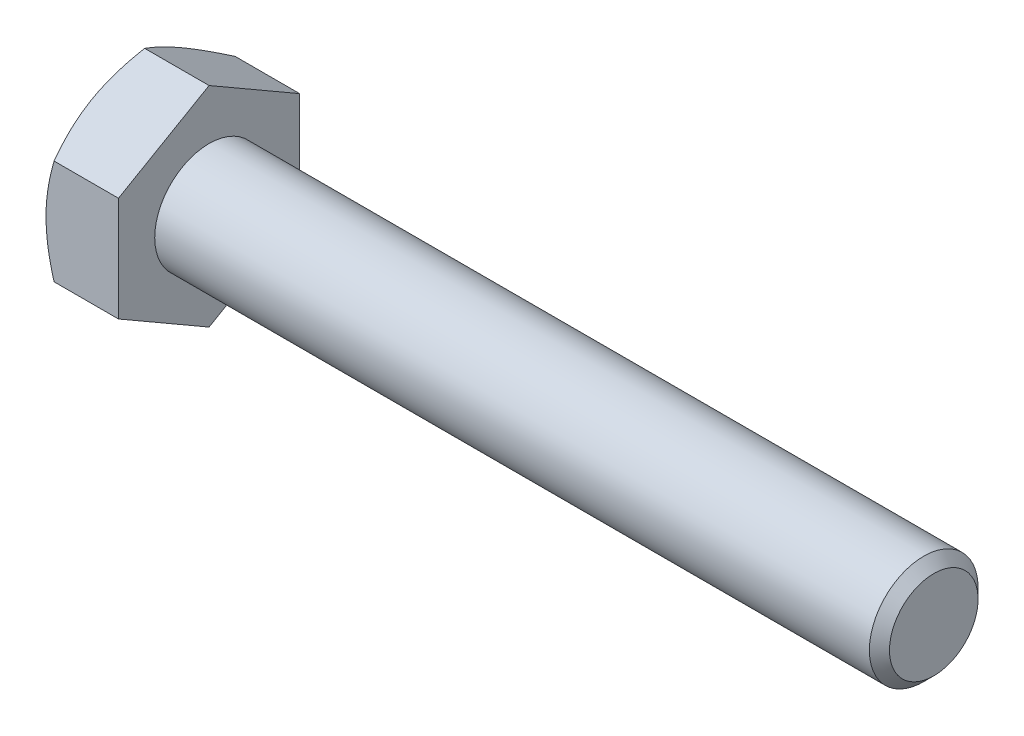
SolidWorks part; units mm, degrees
ref_plane "Plane1" through (0, 0, 0) normal (0, 0, 1) x (1, 0, 0)
ref_plane "Plane2" through (0, 0, 0) normal (0, 1, 0) x (1, 0, 0)
ref_plane "Plane3" through (0, 0, 0) normal (1, 0, 0) x (0, 0, -1)
sketch "Sketch1" plane through (0, 0, 0) normal (1, 0, 0) x (0, 0, -1)
  line L0 (5, 2.8868) -> (5, -2.8868)
  line L1 (-5, 2.8868) -> (-5, -2.8868)
  line L2 (5, -2.8868) -> (0, -5.7735)
  line L3 (0, -5.7735) -> (-5, -2.8868)
  line L4 (5, 2.8868) -> (0, 5.7735)
  line L5 (0, 5.7735) -> (-5, 2.8868)
  dimension "Width_flats" = 10
  dimension "D2" = 120
  dimension "D3" = 5
  dimension "D4" = 5
  dimension "D5" = 5
extrude "BaseHead" add sketch "Sketch1" along normal blind 4
sketch "BodySke" plane through (0, 0, 0) normal (0, 0, 1) x (1, 0, 0)
  line L1 (0, 0) -> (44, 0)
  line L2 (0, 0) -> (0, 3)
  line L4 (44, 0) -> (44, 2.4455)
  line L5 (4, 5.7735) -> (4, 2.8868) construction
  line L6 (44, 2.4455) -> (43.4455, 3)
  line L7 (0, 0) -> (110.49, 0) construction
  line L8 (44, -2.4455) -> (43.4455, -3) construction
  line L9 (0, 2.8868) -> (0, -2.8868) construction
  line L10 (5, 15.24) -> (5, -1.27) construction
  line L11 (4, 15.24) -> (4, -1.27) construction
  line L12 (4, 2.8868) -> (4, -2.8868) construction
  line L15 (0, 3) -> (43.4455, 3)
  dimension "Length" = 40
  dimension "Body_ch_ang" = 45
  dimension "Diameter" = 6
  dimension "Minor_dia" = 4.891
  dimension "Advance" = 1
  dimension "Thread_nom" = 40
revolve "BaseBody" add sketch "BodySke" angle 360 about L7
fillet "HeadFillet" [suppressed] radius 0.25
sketch "Sketch3" plane through (0, 0, 0) normal (0, 0, 1) x (1, 0, 0)
  line L0 (0, 5) -> (3.3333, 10.7735)
  line L1 (0, 5.7735) -> (0, 2.8868) construction
  line L2 (3.3333, 10.7735) -> (3.3333, 15.7735)
  line L3 (3.3333, 15.7735) -> (-10, 15.7735)
  line L4 (-10, 15.7735) -> (-10, 5)
  line L5 (-10, 5) -> (0, 5)
  line L6 (0, 0) -> (99.06, 0) construction
  line L7 (4, 5.7735) -> (0, 5.7735) construction
  dimension "D1" = 5
  dimension "D2" = 5
  dimension "D3" = 10
  dimension "D4" = 5
  dimension "Head_ch_ang" = 30
revolve "HeadChamfer" cut sketch "Sketch3" angle 360 about L6
sketch "ThdSchSke" plane through (0, 0, 0) normal (0, 0, 1) x (1, 0, 0)
  line L0 (5, -2.4455) -> (4.6117, -3)
  line L1 (5, -2.4455) -> (5.3883, -3)
  line L2 (5.3883, -3) -> (5.3883, -3.75)
  line L3 (-3.175, 0) -> (5.1513, 0) construction
  line L5 (5.3883, -3.75) -> (4.6117, -3.75)
  line L6 (4.6117, -3.75) -> (4.6117, -3)
  dimension "Thread_minor" = 4.891
  dimension "Diameter" = 6
  dimension "Start" = 5
  dimension "SideAngle" = 55
  dimension "VeeAngle" = 70
  dimension "Overcut" = 7.5
revolve "ThreadSchematic" [suppressed] cut sketch "ThdSchSke" angle 360 about L3
pattern_linear "ThdSchPat" [suppressed]
equation "\"D3@Sketch1\" = \"Width_flats@Sketch1\" / 2"
equation "\"D4@Sketch1\" = \"D3@Sketch1\""
equation "\"D5@Sketch1\" = \"D4@Sketch1\""
equation "\"Thread_minor@ThreadCosmetic\" = \"Minor_dia@BodySke\""
equation "\"D1@Sketch3\" = \"Width_flats@Sketch1\" / 2"
equation "\"Thread_length@ThreadCosmetic\" = ((sgn( (\"Length@BodySke\" - \"Advance@BodySke\" ) - \"Thread_nom@BodySke\" )-1)*( (\"Length@BodySke\" - \"Advance@BodySke\" ) - \"Thread_nom@BodySke\" ))/-2+ \"Thread_nom@BodySke\""
equation "\"Thread_minor@ThdSchSke\" = \"Minor_dia@BodySke\""
equation "\"Diameter@ThdSchSke\" = \"Diameter@BodySke\""
equation "\"Overcut@ThdSchSke\" = \"Diameter@BodySke\" * 1.25"
equation "\"Start@ThdSchSke\" = \"Head_ht@BaseHead\" + \"Length@BodySke\" - \"Thread_length@ThreadCosmetic\"  '---Non-countersunk---"
equation "\"Num_threads@ThdSchPat\" = int( \"Thread_length@ThreadCosmetic\" / \"Advance@BodySke\" + 0.999 )  + 1"
equation "\"Advance@ThdSchPat\" = \"Thread_length@ThreadCosmetic\" /  (\"Num_threads@ThdSchPat\" - 1) 'relax it"
equation "\"Num_threads@ThdSchPat\" = \"Num_threads@ThdSchPat\" - sgn( \"Num_threads@ThdSchPat\" - 1) '---chamfered tips only---"
